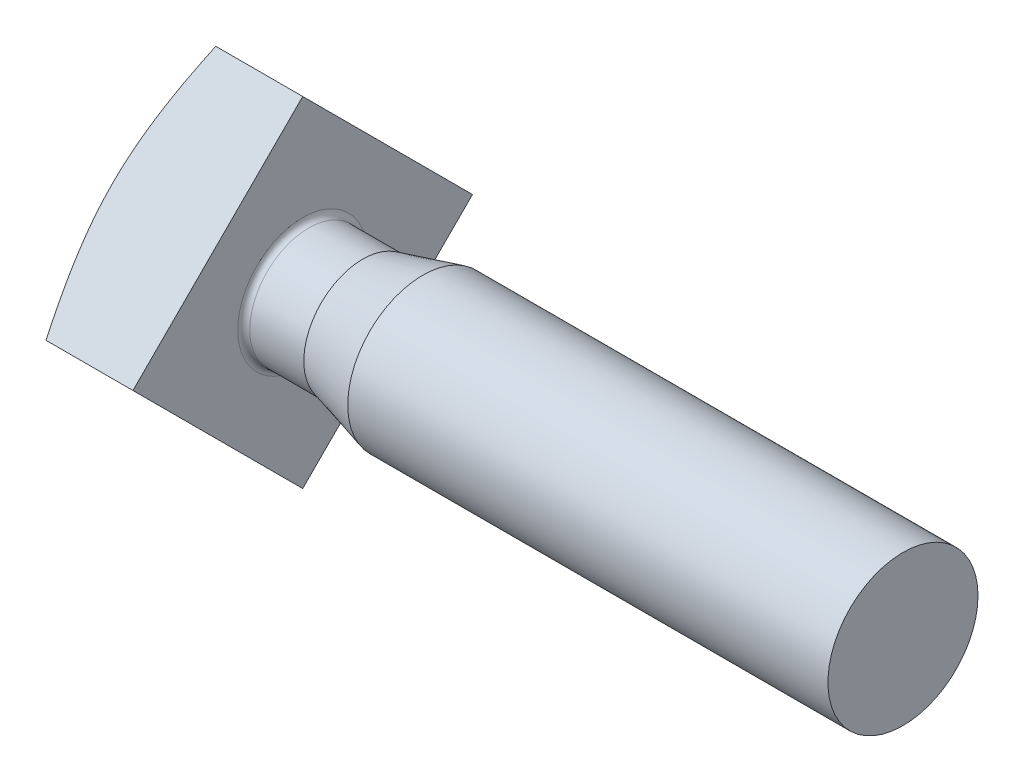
SolidWorks part; units mm, degrees
ref_plane "Front" through (0, 0, 0) normal (0, 0, 1) x (1, 0, 0)
ref_plane "Top" through (0, 0, 0) normal (0, 1, 0) x (1, 0, 0)
ref_plane "Right" through (0, 0, 0) normal (1, 0, 0) x (0, 0, -1)
sketch "Sketch2" plane through (0, 0, 0) normal (1, 0, 0) x (0, 0, -1)
  line L1 (5.6569, 0) -> (0, 5.6569)
  line L2 (0, 5.6569) -> (-5.6569, 0)
  line L3 (-5.6569, 0) -> (0, -5.6569)
  line L4 (0, -5.6569) -> (5.6569, 0)
  circle A0 centre (0, 0) radius 4 construction
  dimension "s" = 8
extrude "BaseHead" add sketch "Sketch2" along normal blind 3.5
sketch "Sketch3" plane through (3.5, 0, 0) normal (1, 0, 0) x (0, 0, -1)
  circle A0 centre (0, 0) radius 2.5
  dimension "d" = 5
extrude "BaseBody" add sketch "Sketch3" along normal blind 20
sketch "Sketch4" plane through (0, 0, 0) normal (0, 0, 1) x (1, 0, 0)
  line L0 (0, 5.6569) -> (0.603, 5.6569)
  line L1 (0, -4) -> (0, 4) construction
  line L2 (0.603, 5.6569) -> (0, 4)
  line L4 (0, 4) -> (0, 5.6569)
  line L5 (-0.7798, 0) -> (6.4752, 0) construction
  line L7 (3.5, 5.6569) -> (0, 5.6569) construction
  dimension "D1" = 20
  dimension "D2" = 8
revolve "HeadChamfer" cut sketch "Sketch4" angle 360 about L5
sketch "Sketch5" plane through (0, 0, 0) normal (-1, 0, 0) x (0, 0, 1)
  circle A0 centre (0, 0) radius 3.6
  dimension "D1" = 7.2
extrude "Cut-Extrude1" cut sketch "Sketch5" against normal blind 0.7
sketch "Sketch6" plane through (0, 0, 0) normal (0, 0, 1) x (1, 0, 0)
  line L0 (3.5, 1.9641) -> (5.5, 1.9641)
  line L1 (5.5, 1.9641) -> (7.5, 2.5)
  line L2 (23.5, 2.5) -> (3.5, 2.5) construction
  line L3 (7.5, 2.5) -> (3.5, 2.5)
  line L4 (3.5, 2.5) -> (3.5, 1.9641)
  line L5 (3.5, -2.5) -> (3.5, 2.5) construction
  line L6 (3.5, 5.6569) -> (3.5, 0) construction
  dimension "X" = 2
  dimension "D2" = 4
  dimension "D3" = 15
revolve "Cut-Revolve1" cut sketch "Sketch6" angle 360 about axis through (23.5, 0, 0) along (-1, 0, 0)
fillet "HeadFillet1" radius 0.2 1 edges at (3.5, 0, -1.9641)
sketch "Sketch7" plane through (0, 0, 0) normal (0, 0, 1) x (1, 0, 0)
  line L0 (23.1875, 3.125) -> (23.8125, 3.125)
  line L1 (23.8125, 3.125) -> (23.8125, 2.5)
  line L2 (23.8125, 2.5) -> (23.5, 1.9587)
  line L3 (23.5, 1.9587) -> (23.1875, 2.5)
  line L4 (23.1875, 2.5) -> (23.1875, 3.125)
  line L5 (23.5, -2.5) -> (23.5, 2.5) construction
  line L6 (23.5, 2.5) -> (7.5, 2.5) construction
  dimension "D1" = 0.625
revolve "Cut-Revolve10" [suppressed] cut sketch "Sketch7" angle 360
pattern_linear "LPattern10" [suppressed] count 21
equation "\"D2@Sketch4\" = \"s@Sketch2\""
equation "\"D1@Sketch5\" = \"s@Sketch2\" * 0.9"
equation "\"D1@Cut-Extrude1\" = 0.2 * \"k@BaseHead\""
equation "\"D2@Sketch6\" = \"l@BaseBody\" - \"b@ThreadCosmetic1\""
equation "\"D1@Sketch7\" =  ( \"d@Sketch3\" - \"D2@ThreadCosmetic1\" )  / 2"
equation "\"pitch@LPattern10\" = 1.2 * \"D1@Sketch7\""
equation " \"D1@LPattern10\" = \"b@ThreadCosmetic1\" / \"pitch@LPattern10\""
